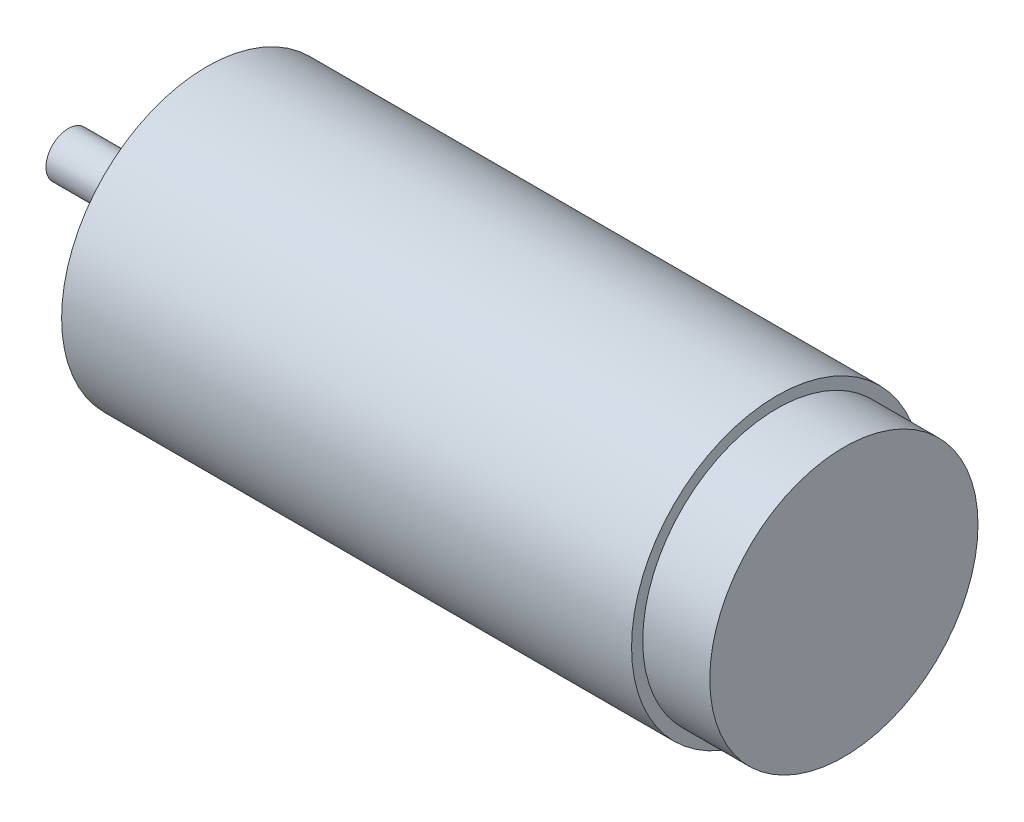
SolidWorks part; units mm, degrees
ref_plane "Face" through (0, 0, 0) normal (0, 0, 1) x (1, 0, 0)
ref_plane "Dessus" through (0, 0, 0) normal (0, 1, 0) x (1, 0, 0)
ref_plane "Droite" through (0, 0, 0) normal (1, 0, 0) x (0, 0, -1)
sketch "Esquisse1" plane through (0, 0, 0) normal (0, 0, 1) x (1, 0, 0)
  line L0 (0, 0) -> (-98.528, 0) construction
  line L1 (0, 0) -> (0, 12)
  line L2 (0, 12) -> (-6, 12)
  line L3 (-6, 12) -> (-6, 13)
  line L4 (-6, 13) -> (-57, 13)
  line L5 (-57, 13) -> (-57, 5)
  line L6 (-57, 5) -> (-58, 5)
  line L7 (-58, 5) -> (-58, 3.25)
  line L8 (-58, 3.25) -> (-59.4, 3.25)
  line L9 (-59.4, 3.25) -> (-59.4, 2)
  line L10 (-59.4, 2) -> (-69.4, 2)
  line L11 (-69.4, 2) -> (-69.4, 0)
  line L12 (0, 0) -> (-69.4, 0)
  dimension "D1" = 4
  dimension "D2" = 6.5
  dimension "D3" = 10
  dimension "D4" = 26
  dimension "D5" = 24
  dimension "D6" = 6
  dimension "D7" = 57
  dimension "D8" = 1
  dimension "D9" = 2.4
  dimension "D10" = 12.4
revolve "Révolution1" add sketch "Esquisse1" angle 360 about L0
hole_wizard "Trou taraudé M3x0.51" positions "Esquisse3" profile "Esquisse2" tap size "M3x0.5" standard "DIN"
sketch "Esquisse3" plane through (-57, 0, 0) normal (-1, 0, 0) x (0, 0, 1)
  line L0 (0, 0) -> (0, 8.1815) construction
  line L1 (19.8364, 11.4525) -> (-21.824, -12.6001) construction
  line L2 (19.147, -11.0545) -> (-16.6336, 9.6034) construction
  circle A0 centre (0, 0) radius 8.5 construction
  point P0 (0, 8.5)
  point P4 (7.3612, -4.25)
  point P5 (-7.3612, -4.25)
  dimension "D1" = 17
  dimension "D2" = 60
  dimension "D3" = 60
sketch "Esquisse2" plane through (-57, 8.5, 0) normal (0, 1, 0) x (0, 0, 1)
  line L0 (0, 0) -> (0, 6.2217)
  line L1 (0, 6.2217) -> (1.25, 5.5)
  line L2 (1.25, 5.5) -> (1.25, 0.25)
  line L3 (1.25, 0.25) -> (1.5, 0)
  line L5 (1.5, 0) -> (0, 0)
  line L6 (-1.25, 0.25) -> (-1.5, 0) construction
  line L10 (0, 6.2217) -> (-1.25, 5.5) construction
  line L11 (0, -6.35) -> (0, 107.95) construction
  dimension "Diamètre du trou pour taraudage" = 2.5
  dimension "Profondeur du trou pour taraudage" = 5.5
  dimension "Diamètre du fraisage entrant" = 3
  dimension "Angle du fraisage entrant" = 90
  dimension "Angle de pointe" = 120
